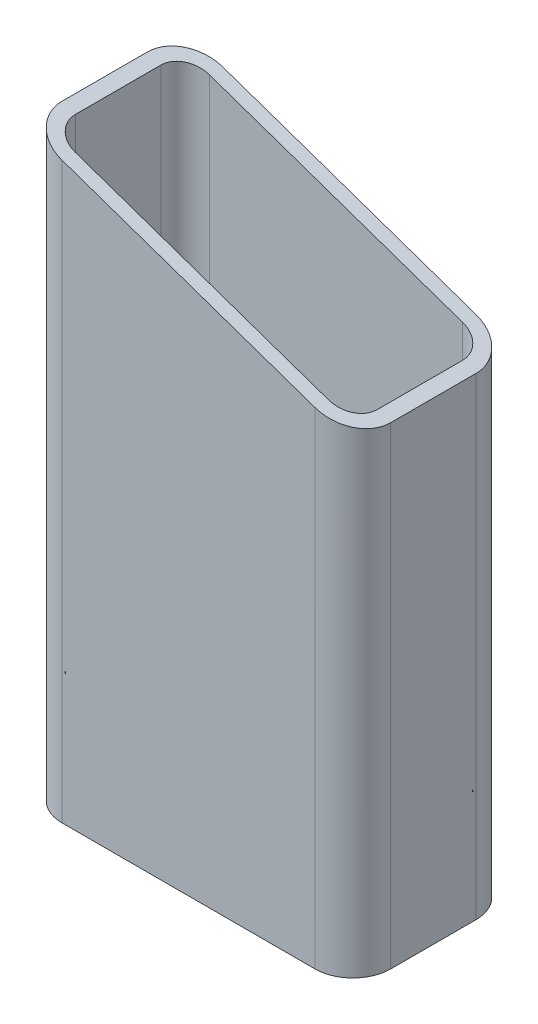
SolidWorks part; units mm, degrees
ref_plane "Alzado" through (0, 0, 0) normal (0, 0, 1) x (1, 0, 0)
ref_plane "Planta" through (0, 0, 0) normal (0, 1, 0) x (1, 0, 0)
ref_plane "Vista lateral" through (0, 0, 0) normal (1, 0, 0) x (0, 0, -1)
sketch "Croquis2" plane through (0, 0, 0) normal (0, 1, 0) x (1, 0, 0)
  line L0 (0, 222.285) -> (0, -222.285) construction
  line L1 (343.7936, 0) -> (-343.7936, 0) construction
  line L21 (-75.5, 40) -> (75.5, 40)
  line L23 (90, 25.5) -> (90, -25.5)
  line L40 (-75.5, 48) -> (75.5, 48)
  line L41 (98, 25.5) -> (98, -25.5)
  line L42 (-98, 25.5) -> (-98, -25.5)
  line L43 (-90, 25.5) -> (-90, -25.5)
  line L44 (90, 25.5) -> (90, -25.5)
  line L45 (98, 25.5) -> (98, -25.5)
  line L46 (-98, 25.5) -> (-98, -25.5)
  line L47 (-90, 25.5) -> (-90, -25.5)
  line L48 (90, 25.5) -> (90, -25.5)
  line L49 (98, 25.5) -> (98, -25.5)
  line L50 (-98, 25.5) -> (-98, -25.5)
  line L51 (-90, 25.5) -> (-90, -25.5)
  line L52 (90, 25.5) -> (90, -25.5)
  line L53 (98, 25.5) -> (98, -25.5)
  line L54 (-98, 25.5) -> (-98, -25.5)
  line L55 (-90, 25.5) -> (-90, -25.5)
  line L56 (-75.5, -48) -> (75.5, -48)
  line L57 (-75.5, -40) -> (75.5, -40)
  arc A49 (98, 25.5) -> (75.5, 48) centre (75.5, 25.5) ccw
  arc A50 (90, 25.5) -> (75.5, 40) centre (75.5, 25.5) ccw
  arc A51 (-90, 25.5) -> (-75.5, 40) centre (-75.5, 25.5) cw
  arc A52 (-98, 25.5) -> (-75.5, 48) centre (-75.5, 25.5) cw
  arc A53 (98, 25.5) -> (75.5, 48) centre (75.5, 25.5) ccw
  arc A54 (90, 25.5) -> (75.5, 40) centre (75.5, 25.5) ccw
  arc A55 (-90, 25.5) -> (-75.5, 40) centre (-75.5, 25.5) cw
  arc A56 (-98, 25.5) -> (-75.5, 48) centre (-75.5, 25.5) cw
  arc A57 (98, 25.5) -> (75.5, 48) centre (75.5, 25.5) ccw
  arc A58 (90, 25.5) -> (75.5, 40) centre (75.5, 25.5) ccw
  arc A59 (-90, 25.5) -> (-75.5, 40) centre (-75.5, 25.5) cw
  arc A60 (-98, 25.5) -> (-75.5, 48) centre (-75.5, 25.5) cw
  arc A61 (98, 25.5) -> (75.5, 48) centre (75.5, 25.5) ccw
  arc A62 (90, 25.5) -> (75.5, 40) centre (75.5, 25.5) ccw
  arc A63 (-90, 25.5) -> (-75.5, 40) centre (-75.5, 25.5) cw
  arc A64 (-98, 25.5) -> (-75.5, 48) centre (-75.5, 25.5) cw
  arc A65 (-98, -25.5) -> (-75.5, -48) centre (-75.5, -25.5) ccw
  arc A66 (-90, -25.5) -> (-75.5, -40) centre (-75.5, -25.5) ccw
  arc A67 (90, -25.5) -> (75.5, -40) centre (75.5, -25.5) cw
  arc A68 (98, -25.5) -> (75.5, -48) centre (75.5, -25.5) cw
  arc A69 (-98, -25.5) -> (-75.5, -48) centre (-75.5, -25.5) ccw
  arc A70 (-90, -25.5) -> (-75.5, -40) centre (-75.5, -25.5) ccw
  arc A71 (90, -25.5) -> (75.5, -40) centre (75.5, -25.5) cw
  arc A72 (98, -25.5) -> (75.5, -48) centre (75.5, -25.5) cw
  arc A73 (-98, -25.5) -> (-75.5, -48) centre (-75.5, -25.5) ccw
  arc A74 (-90, -25.5) -> (-75.5, -40) centre (-75.5, -25.5) ccw
  arc A75 (90, -25.5) -> (75.5, -40) centre (75.5, -25.5) cw
  arc A76 (98, -25.5) -> (75.5, -48) centre (75.5, -25.5) cw
  arc A77 (-98, -25.5) -> (-75.5, -48) centre (-75.5, -25.5) ccw
  arc A78 (-90, -25.5) -> (-75.5, -40) centre (-75.5, -25.5) ccw
  arc A79 (90, -25.5) -> (75.5, -40) centre (75.5, -25.5) cw
  arc A80 (98, -25.5) -> (75.5, -48) centre (75.5, -25.5) cw
  point P4 (0, 0)
  point P7 (0, 0)
  point P9 (0, -40)
  point P10 (-98, 0)
  point P12 (90, 0)
  point P22 (98, 0)
  point P23 (0, 48)
  point P24 (0, 40)
  point P34 (-90, 0)
  point P35 (0, -48)
  dimension "D3" = 8
  dimension "D4" = 22.5
  dimension "D1" = 48
  dimension "D2" = 98
extrude "Saliente-Extruir1" add sketch "Croquis2" along normal blind 350 contours A68 L41 A49 L40 A52 L42 A65 L56 L23 A67 L57 A66 L43 A51 L21 A50
sketch "Croquis3" plane through (0, 0, 48) normal (0, 0, 1) x (1, 0, 0)
  line L0 (-98, 350) -> (98, 282.0628)
  line L1 (-98, 350) -> (-98, 250.7646) construction
  line L3 (-98, 350) -> (-98, 0) construction
  line L4 (-98, 350) -> (-16.7675, 453.1002) construction
  line L9 (98, 350) -> (98, 0) construction
  line L12 (-98, 350) -> (98, 350)
  line L13 (98, 350) -> (98, 282.0628)
  dimension "D1" = 141.765
  dimension "D2" = 70.883
extrude "Cortar-Extruir1" cut sketch "Croquis3" against normal through all
